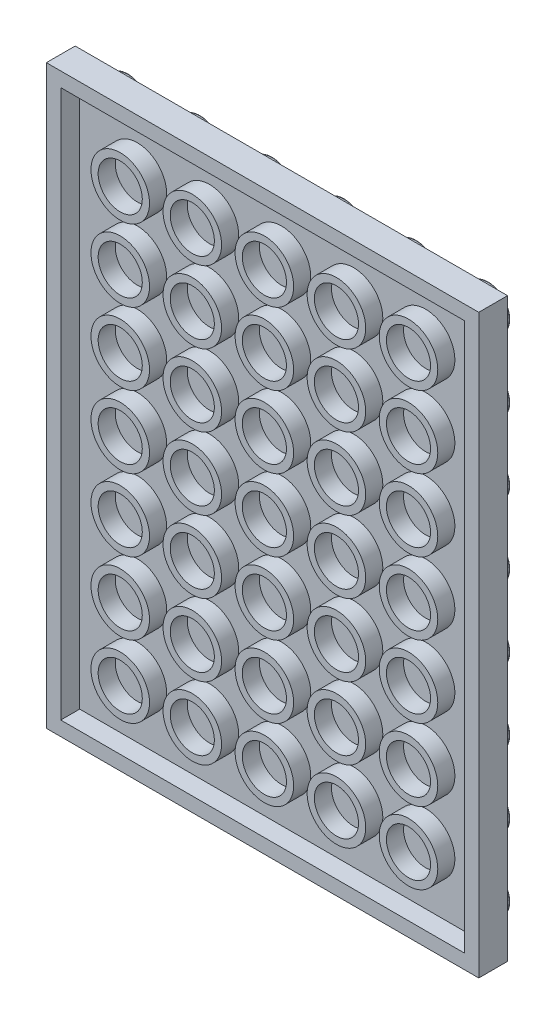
SolidWorks part; units mm, degrees
ref_plane "Vorne" through (0, 0, 0) normal (0, 0, 1) x (1, 0, 0)
ref_plane "Oben" through (0, 0, 0) normal (0, 1, 0) x (1, 0, 0)
ref_plane "Rechts" through (0, 0, 0) normal (1, 0, 0) x (0, 0, -1)
sketch "Skizze1" plane through (0, 0, 0) normal (0, 0, 1) x (1, 0, 0)
  line L1 (0, 0) -> (-48, 0)
  line L2 (0, 0) -> (0, -64)
  line L3 (0, -64) -> (-48, -64)
  line L4 (-48, 0) -> (-48, -64)
  dimension "D1" = 48
  dimension "D2" = 64
extrude "Linear austragen1" add sketch "Skizze1" along normal blind 3.2
sketch "Skizze2" plane through (0, 0, 3.2) normal (0, 0, 1) x (1, 0, 0)
  line L0 (-48, -64) -> (0, -64) construction
  line L1 (-1.6, -62.4) -> (-46.4, -62.4)
  line L2 (-1.6, -62.4) -> (-1.6, -1.6)
  line L3 (-1.6, -1.6) -> (-46.4, -1.6)
  line L4 (-46.4, -62.4) -> (-46.4, -1.6)
  line L5 (0, -64) -> (0, 0) construction
  line L6 (-48, 0) -> (-48, -64) construction
  line L7 (0, 0) -> (-48, 0) construction
  dimension "D1" = 1.6
  dimension "D2" = 1.6
  dimension "D3" = 1.6
  dimension "D4" = 1.6
extrude "Schnitt-Linear austragen1" cut sketch "Skizze2" against normal blind 2.1
sketch "Skizze3" plane through (0, 0, 1.1) normal (0, 0, 1) x (1, 0, 0)
  line L0 (0, -64) -> (0, 0) construction
  line L2 (0, 0) -> (-48, 0) construction
  circle A0 centre (-8, -8) radius 3.25
  circle A1 centre (-8, -8) radius 2.45
  dimension "D1" = 6.5
  dimension "D2" = 4.9
  dimension "D3" = 8
  dimension "D4" = 8
extrude "Linear austragen2" add sketch "Skizze3" along normal blind 1.9
sketch "Skizze4" plane through (0, 0, 0) normal (0, 0, -1) x (-1, 0, 0)
  line L0 (0, 0) -> (48, 0) construction
  line L1 (0, -64) -> (0, 0) construction
  circle A0 centre (4, -4) radius 2.45
  dimension "D1" = 4.9
  dimension "D2" = 4
  dimension "D3" = 4
extrude "Linear austragen3" add sketch "Skizze4" along normal blind 1.9
fillet "Verrundung1" radius 0.2 1 edges at (-6.45, -4, -1.9)
sketch "Skizze8" plane through (0, 0, -1.9) normal (0, 0, -1) x (-1, 0, 0)
  line L0 (4.5102, -5.6382) -> (4.746, -2.1452) construction
  text T0 "Lego  " font "SWIsop1" height in points 5
extrude "Linear austragen4" add sketch "Skizze8" along normal blind 0.2
pattern_linear "Lineares Muster1" count 6 spacing 8 along (-1, 0, 0) count 8 spacing 8 along (0, -1, 0) of "Verrundung1", "Linear austragen3"
pattern_linear "Lineares Muster2" count 7 spacing 8 along (0, -1, 0) count 5 spacing 8 along (-1, 0, 0) of "Linear austragen2"
